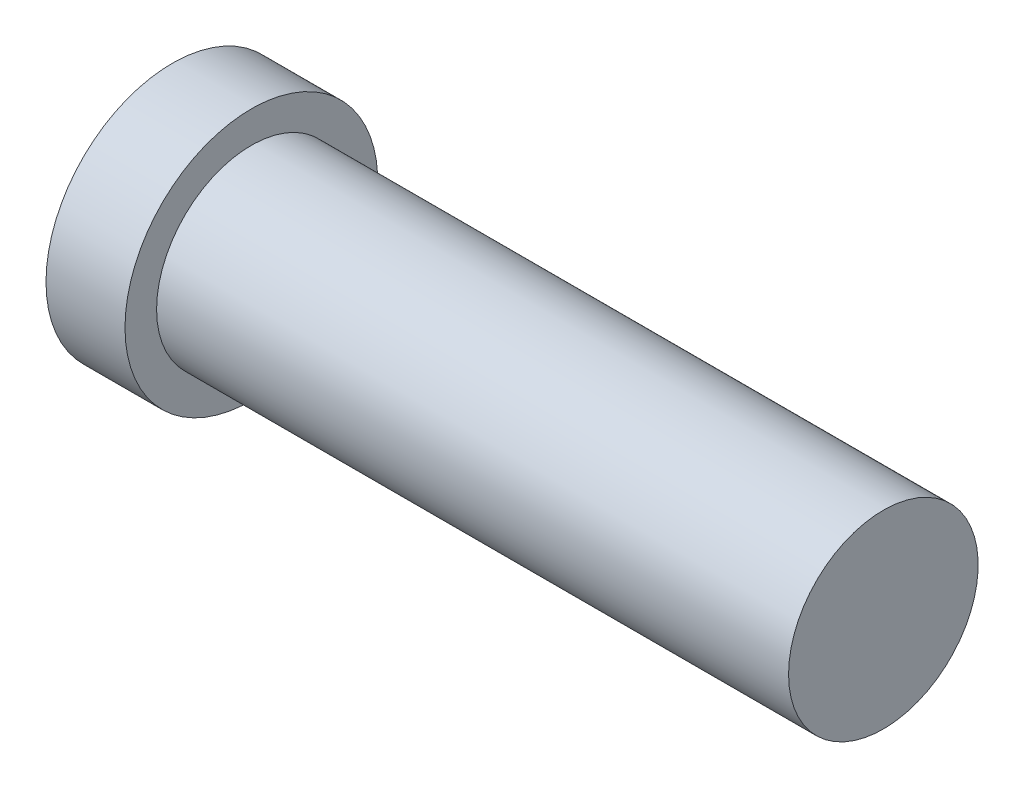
SolidWorks part; units mm, degrees
ref_plane "Plan1" through (0, 0, 0) normal (0, 0, 1) x (1, 0, 0)
ref_plane "Plan2" through (0, 0, 0) normal (0, 1, 0) x (1, 0, 0)
ref_plane "Plan3" through (0, 0, 0) normal (1, 0, 0) x (0, 0, -1)
sketch "Esquisse1" plane through (0, 0, 0) normal (0, 0, 1) x (1, 0, 0)
  line L0 (-45, 0) -> (-45, 8)
  line L1 (-45, 8) -> (-40, 8)
  line L2 (-40, 8) -> (-40, 6)
  line L3 (-40, 6) -> (0, 6)
  line L4 (0, 6) -> (0, 0)
  line L5 (0, 0) -> (-45, 0)
  line L6 (-90, 0) -> (20, 0) construction
  dimension "D1" = 5
  dimension "D2" = 40
  dimension "D3" = 6
  dimension "D4" = 8
revolve "Base-Révolution" add sketch "Esquisse1" angle 360 about L6
